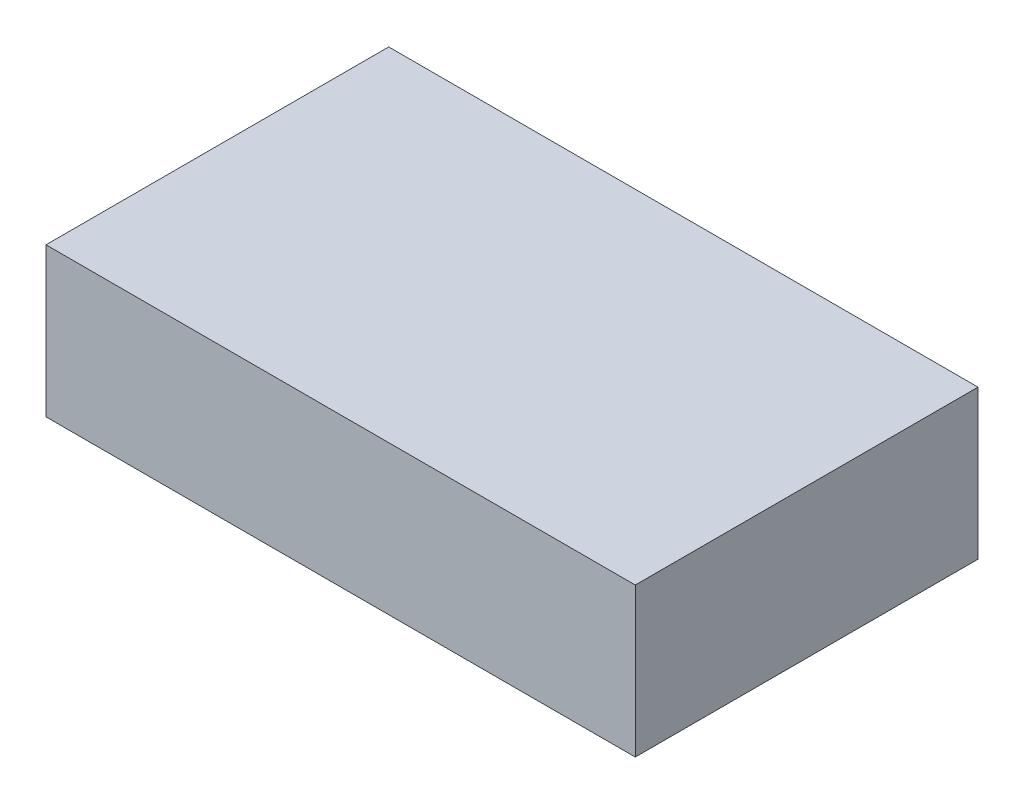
SolidWorks part; units mm, degrees
ref_plane "Plan de face" through (0, 0, 0) normal (0, 0, 1) x (1, 0, 0)
ref_plane "Plan de dessus" through (0, 0, 0) normal (0, 1, 0) x (1, 0, 0)
ref_plane "Plan de droite" through (0, 0, 0) normal (1, 0, 0) x (0, 0, -1)
sketch "Esquisse1" plane through (0, 0, 0) normal (0, 0, 1) x (1, 0, 0)
  line L1 (0, 0) -> (87, 0)
  line L2 (0, 0) -> (0, 22)
  line L3 (0, 22) -> (87, 22)
  line L4 (87, 0) -> (87, 22)
  dimension "D1" = 87
  dimension "D2" = 22
extrude "Extrusion1" add sketch "Esquisse1" along normal blind 50.6
